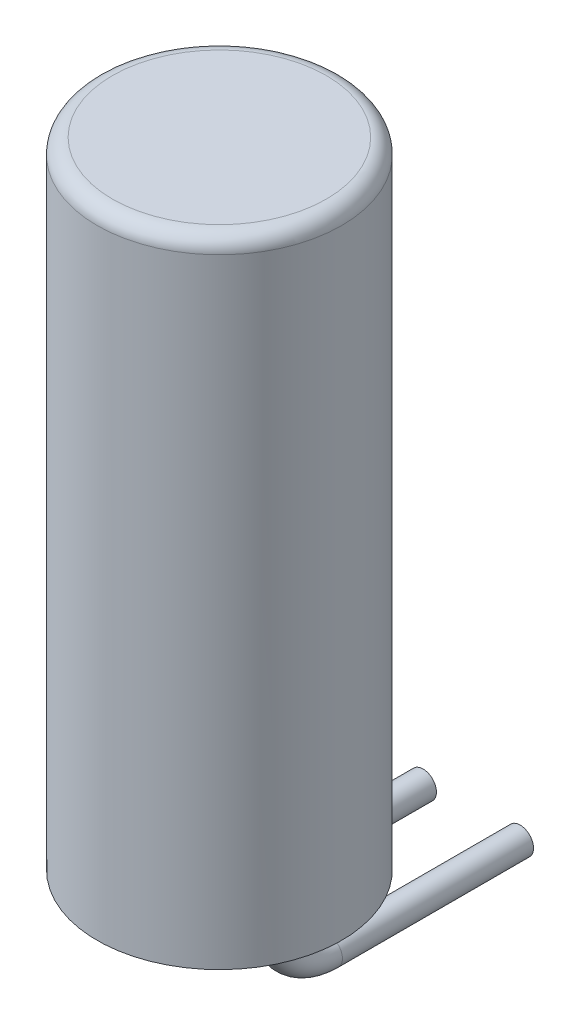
SolidWorks part; units mm, degrees
ref_plane "Plan de face" through (0, 0, 0) normal (0, 0, 1) x (1, 0, 0)
ref_plane "Plan de dessus" through (0, 0, 0) normal (0, 1, 0) x (1, 0, 0)
ref_plane "Plan de droite" through (0, 0, 0) normal (1, 0, 0) x (0, 0, -1)
sketch "Esquisse1" plane through (0, 0, 0) normal (0, 1, 0) x (1, 0, 0)
  circle A0 centre (0, 0) radius 1.6
extrude "Boss.-Extru.1" add sketch "Esquisse1" along normal blind 8.3
fillet "Congé1" radius 0.2 1 edges at (0, 8.3, 1.6)
sketch "Esquisse2" plane through (0, 0, 0) normal (0, -1, 0) x (1, 0, 0)
  line L0 (1.809, 0) -> (-0.5117, 0) construction
  line L1 (0, -0.2397) -> (0, 1.1382) construction
  line L2 (0.635, -0.2397) -> (0.635, 1.0012) construction
  circle A0 centre (0.635, 0) radius 0.175
  circle A1 centre (-0.635, 0) radius 0.175
  dimension "D1" = 0.635
ref_plane "Plan1" through (0.635, 0, 0) normal (1, 0, 0) x (0, 0, -1)
sketch "Esquisse3" plane through (0.635, 0, 0) normal (1, 0, 0) x (0, 0, -1)
  line L0 (0, 0.4558) -> (0, -1.2096) construction
  line L1 (1.9297, 0) -> (-1.9068, 0) construction
  line L2 (1.9297, -1) -> (-1.9068, -1) construction
  line L3 (1.6, -1.5672) -> (1.6, 2.4234) construction
  line L4 (1.6, 0) -> (1.6, 8.1) construction
  line L5 (3.3, -1.5672) -> (3.3, 2.4234) construction
  line L6 (0, 0) -> (0, -0.2)
  line L7 (0.8, -1) -> (3.3, -1)
  arc A0 (0, -0.2) -> (0.8, -1) centre (0.8, -0.2) ccw
  point P18 (0, -1)
  dimension "D3" = 0.8
  dimension "D1" = 1
  dimension "D2" = 1.7
sweep "Balayage1" add profiles "Esquisse2" path "Esquisse3"
